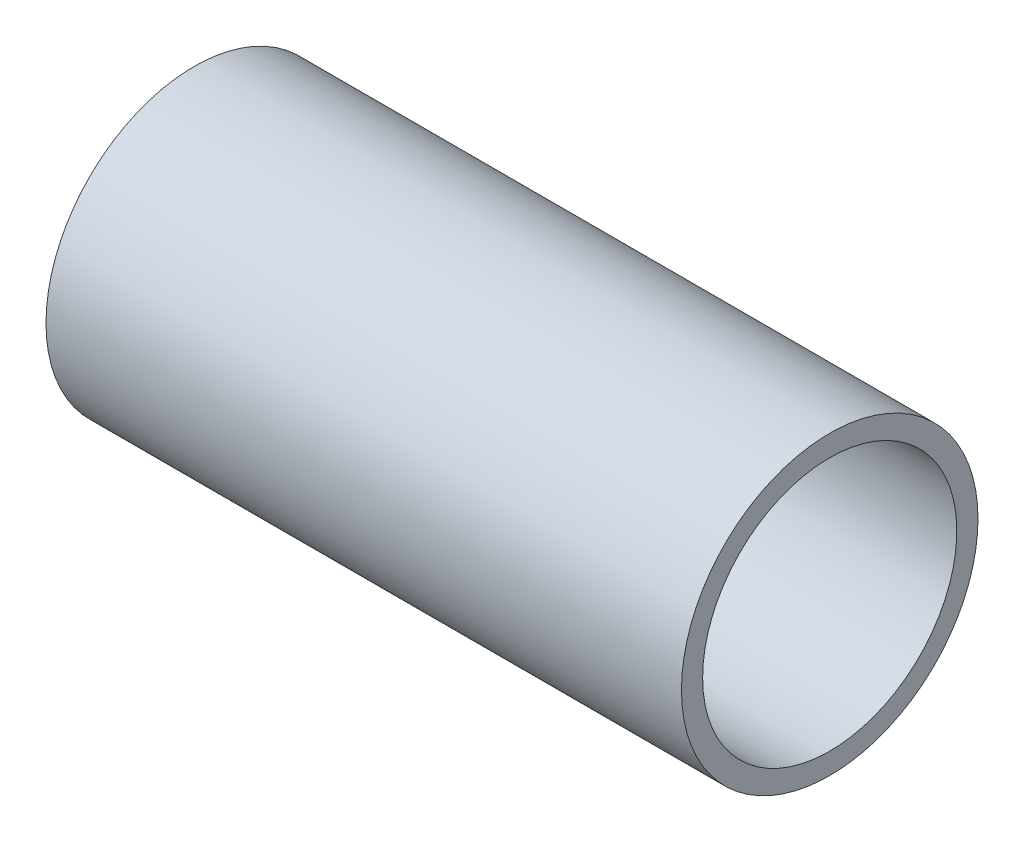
SolidWorks part; units mm, degrees
ref_plane "Plan de face" through (0, 0, 0) normal (0, 0, 1) x (1, 0, 0)
ref_plane "Plan de dessus" through (0, 0, 0) normal (0, 1, 0) x (1, 0, 0)
ref_plane "Plan de droite" through (0, 0, 0) normal (1, 0, 0) x (0, 0, -1)
sketch "Esquisse2" plane through (-15, 0, 0) normal (-1, 0, 0) x (0, 0, 1)
  circle A0 centre (2, 380) radius 7
  circle A1 centre (2, 380) radius 6
  circle A2 centre (2, 380) radius 6 construction
  circle A3 centre (2, 380) radius 7 construction
extrude "Extrusion1" add sketch "Esquisse2" against normal up to surface (30 mm away)
